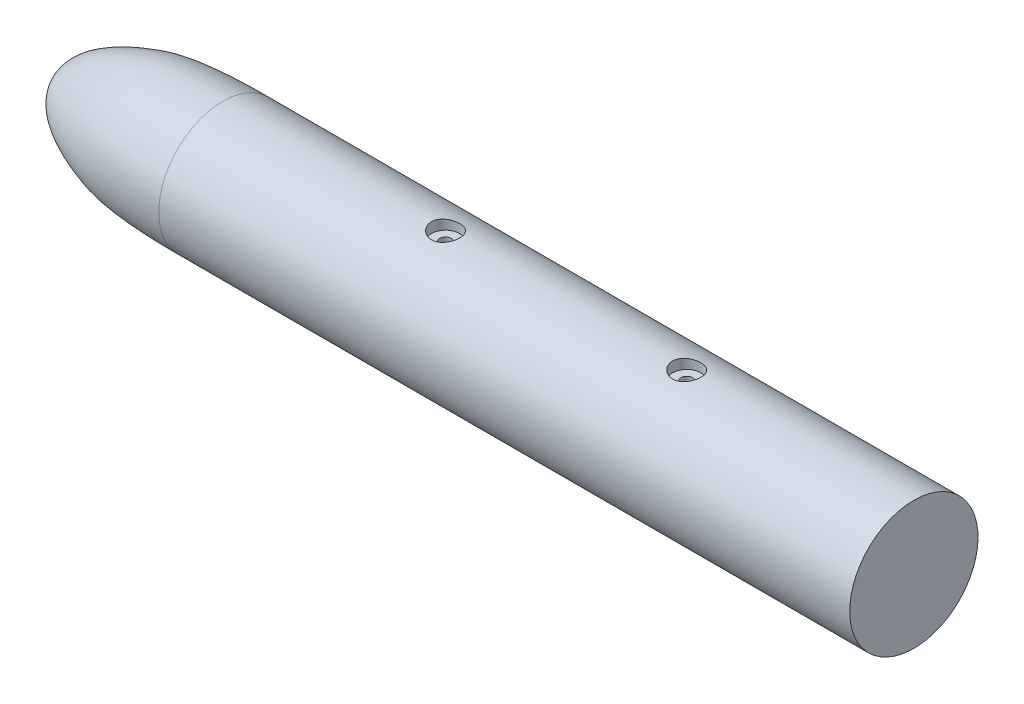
SolidWorks part; units mm, degrees
ref_plane "Ebene vorne" through (0, 0, 0) normal (0, 0, 1) x (1, 0, 0)
ref_plane "Ebene oben" through (0, 0, 0) normal (0, 1, 0) x (1, 0, 0)
ref_plane "Ebene rechts" through (0, 0, 0) normal (1, 0, 0) x (0, 0, -1)
sketch "Skizze4" plane through (0, 0, 0) normal (0, 0, 1) x (1, 0, 0)
  line L0 (40.482, 72.2068) -> (274.0547, 72.2068) construction
  line L1 (258.1087, 24.1447) -> (258.1492, 124.1447) construction
  line L2 (157.9072, 234.6153) -> (727.2405, 234.6153) construction
  line L3 (258.129, 74.1447) -> (25.5481, 74.1447) construction
  line L4 (37.8142, 154.8511) -> (37.8142, -8.7137) construction
  line L5 (164.275, 124.1447) -> (702.8142, 124.1447)
  line L8 (702.8142, 124.1447) -> (702.8142, 74.1447)
  line L9 (702.8142, 74.1447) -> (37.8142, 74.1447)
  spline S0 degree 3 poles (164.275, 124.1447) (136.0956, 124.1447) (107.838, 122.2263) (74.8345, 112.406) (37.8142, 98.4388) (37.8142, 74.1447) knots 0 0 0 0 0.389084 0.472741 1 1 1 1
  dimension "D1" = 100
  dimension "D4" = 50
  dimension "D5" = 665
revolve "Rotation2" add sketch "Skizze4" angle 360 about L9
ref_plane "Ebene1" through (0, 124.1447, 0) normal (0, 1, 0) x (1, 0, 0)
ref_plane "Ebene2" through (0, 62.0724, 0) normal (0, 1, 0) x (1, 0, 0)
ref_plane "Ebene3" through (0, 124.1447, 0) normal (0, 1, 0) x (1, 0, 0)
hole_wizard "Stirnsenkung für M8 Senkschraube (Kopf Button)1" positions "Skizze9" profile "Skizze8" counterbore size "M8" standard "ANSI Metrisch"
sketch "Skizze9" plane through (0, 124.1447, 0) normal (0, 1, 0) x (1, 0, 0)
  point P0 (525.8142, 0)
  point P2 (337.8142, 0)
  dimension "D1" = 188
  dimension "D2" = 300
sketch "Skizze8" plane through (525.8142, 124.1447, 0) normal (1, 0, 0) x (0, 0, 1)
  line L0 (0, 0) -> (0, 100)
  line L1 (0, 100) -> (4.5, 100)
  line L3 (4.5, 100) -> (4.5, 8)
  line L4 (4.5, 8) -> (11, 8)
  line L5 (11, 8) -> (11, 0)
  line L7 (11, 0) -> (0, 0)
  line L11 (0, -6.35) -> (0, 107.95) construction
  dimension "Bohrerdurchmesser" = 9
  dimension "Bohrungstiefe" = 100
  dimension "Senkdurchmesser2" = 22
  dimension "Senktiefe2" = 8
ref_plane "Ebene4" through (0, 24.1447, 0) normal (0, -1, 0) x (-1, 0, 0)
hole_wizard "Stirnsenkung für M8 Senkschraube (Kopf Button)2" positions "Skizze11" profile "Skizze10" counterbore size "M8" standard "ANSI Metrisch"
sketch "Skizze11" plane through (0, 24.1447, 0) normal (0, -1, 0) x (-1, 0, 0)
  point P0 (-337.8142, 0)
  point P3 (-525.8142, 0)
sketch "Skizze10" plane through (337.8142, 24.1447, 0) normal (1, 0, 0) x (0, 0, -1)
  line L0 (0, 0) -> (0, 100)
  line L1 (0, 100) -> (4.5, 100)
  line L3 (4.5, 100) -> (4.5, 8)
  line L4 (4.5, 8) -> (7.5, 8)
  line L5 (7.5, 8) -> (7.5, 0)
  line L7 (7.5, 0) -> (0, 0)
  line L11 (0, -6.35) -> (0, 107.95) construction
  dimension "Bohrerdurchmesser" = 9
  dimension "Bohrungstiefe" = 100
  dimension "Senkdurchmesser2" = 15
  dimension "Senktiefe2" = 8
